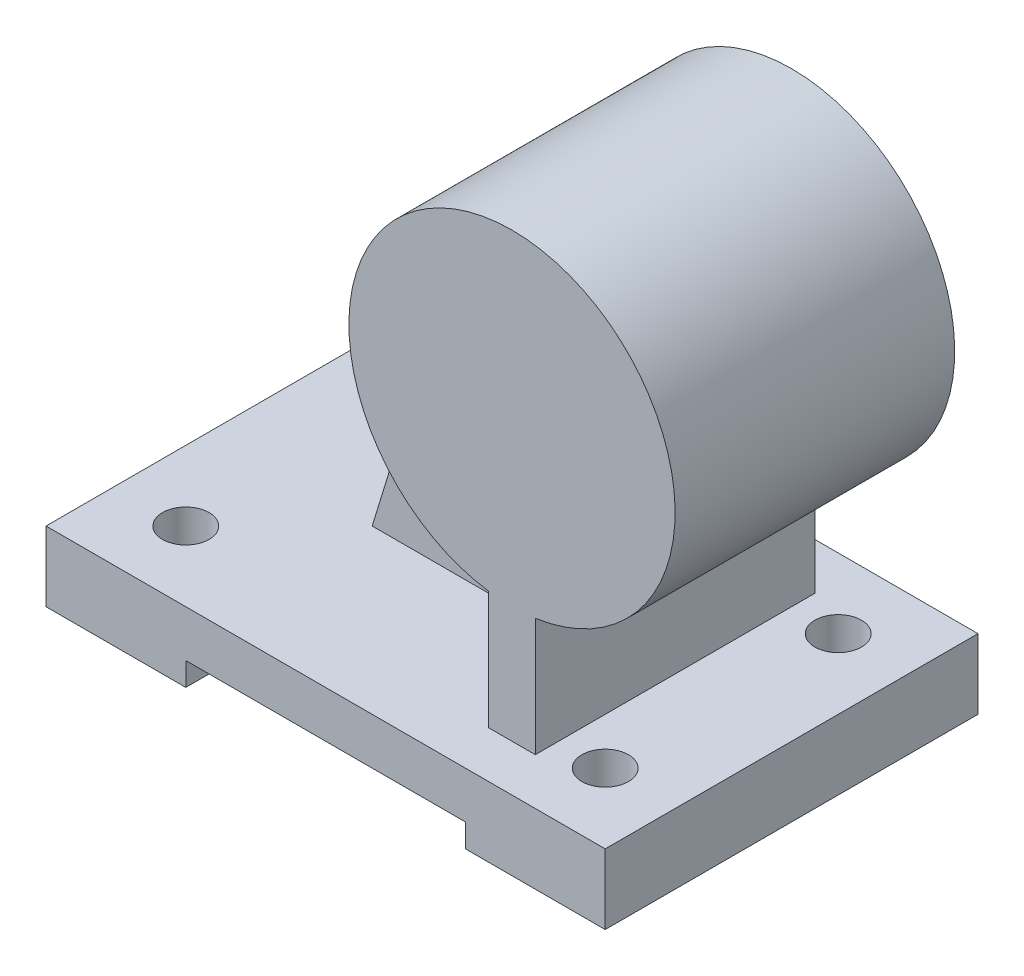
SolidWorks part; units mm, degrees
ref_plane "Front Plane" through (0, 0, 0) normal (0, 0, 1) x (1, 0, 0)
ref_plane "Top Plane" through (0, 0, 0) normal (0, 1, 0) x (1, 0, 0)
ref_plane "Right Plane" through (0, 0, 0) normal (1, 0, 0) x (0, 0, -1)
sketch "Sketch1" plane through (0, 0, 0) normal (0, 1, 0) x (1, 0, 0)
  line L0 (0, 0) -> (3048, 0)
  line L1 (3048, 0) -> (3048, 2032)
  line L2 (3048, 2032) -> (0, 2032)
  line L3 (0, 2032) -> (0, 0)
  dimension "D1" = 2032
  dimension "D2" = 3048
extrude "Boss-Extrude1" add sketch "Sketch1" along normal blind 381
sketch "Sketch3" plane through (0, 0, 0) normal (0, 0, 1) x (1, 0, 0)
  line L0 (0, 0) -> (762, 0) construction
  line L1 (0, 0) -> (3048, 0) construction
  line L2 (762, 0) -> (2286, 0)
  line L3 (2286, 0) -> (2286, 127)
  line L4 (2286, 127) -> (762, 127)
  line L5 (762, 127) -> (762, 0)
  dimension "D1" = 762
  dimension "D2" = 127
  dimension "D3" = 1524
extrude "Cut-Extrude1" cut sketch "Sketch3" against normal through all
sketch "Sketch4" plane through (0, 381, 0) normal (0, 1, 0) x (1, 0, 0)
  line L0 (0, 0) -> (381, 0) construction
  line L1 (0, 0) -> (3048, 0) construction
  line L2 (381, 0) -> (381, 381) construction
  line L3 (1524, 0) -> (1524, 2032) construction
  line L4 (3048, 2032) -> (0, 2032) construction
  line L5 (3048, 1016) -> (0, 1016) construction
  line L6 (3048, 0) -> (3048, 2032) construction
  line L7 (0, 2032) -> (0, 0) construction
  circle A0 centre (381, 381) radius 127
  circle A1 centre (381, 1651) radius 127
  circle A2 centre (2667, 381) radius 127
  circle A3 centre (2667, 1651) radius 127
  dimension "D3" = 254
  dimension "D1" = 381
  dimension "D2" = 381
extrude "Cut-Extrude2" cut sketch "Sketch4" against normal through all
ref_plane "Plane1" through (0, 0, -254) normal (0, 0, 1) x (1, 0, 0)
sketch "Sketch5" plane through (0, 0, -254) normal (0, 0, 1) x (1, 0, 0)
  line L0 (3048, 381) -> (2413, 381) construction
  line L1 (0, 381) -> (3048, 381) construction
  line L2 (2413, 381) -> (2159, 381)
  line L3 (2413, 381) -> (2413, 1025.1182)
  line L4 (2159, 381) -> (2159, 1025.1182)
  line L5 (2286, 381) -> (2286, 1905) construction
  arc A1 (2413, 1025.1182) -> (2159, 1025.1182) centre (2286, 1905) ccw
  dimension "D7" = 1778
  dimension "D1" = 635
  dimension "D2" = 254
  dimension "D5" = 1524
extrude "Boss-Extrude2" add sketch "Sketch5" against normal blind 1524
ref_plane "Plane2" through (0, 0, -1016) normal (0, 0, 1) x (1, 0, 0)
sketch "Sketch6" plane through (0, 0, -1016) normal (0, 0, 1) x (1, 0, 0)
  line L0 (0, 381) -> (889, 381) construction
  line L1 (0, 381) -> (3048, 381) construction
  line L2 (889, 381) -> (1436.038, 2165.5485)
  line L3 (889, 381) -> (2266.7191, 381)
  line L4 (2266.7191, 381) -> (2266.7191, 2165.5485)
  line L5 (2266.7191, 2165.5485) -> (1436.038, 2165.5485)
  arc A0 (2413, 1025.1182) -> (2159, 1025.1182) centre (2286, 1905) ccw construction
  dimension "D1" = 889
extrude "Boss-Extrude3" add sketch "Sketch6" along normal mid plane 254
